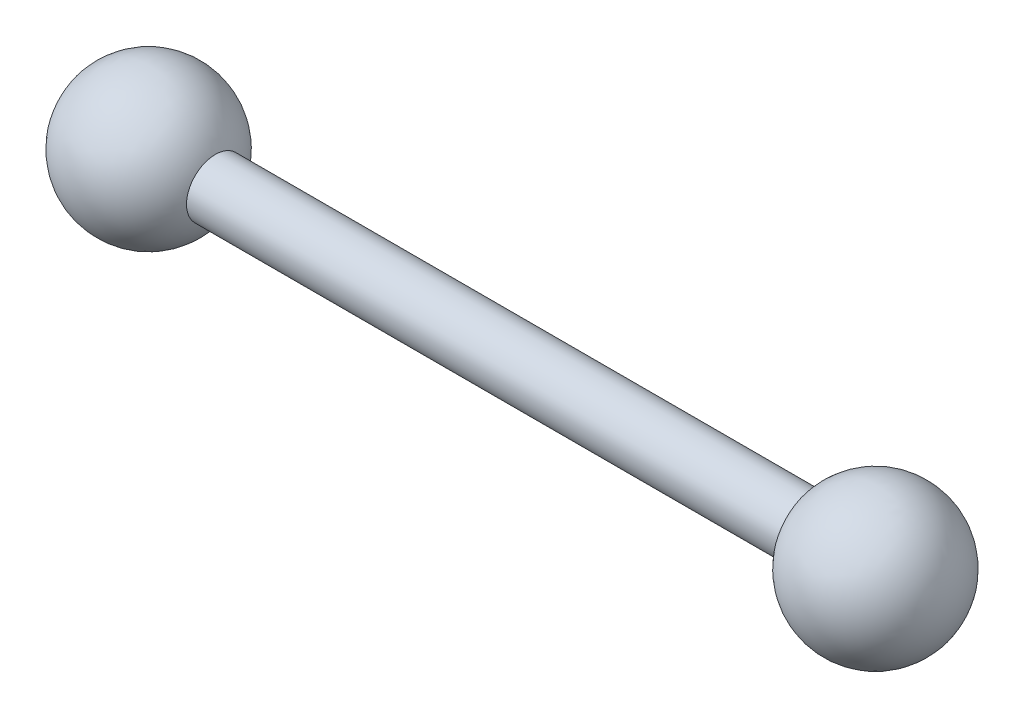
SolidWorks part; units mm, degrees
ref_plane "Plan1" through (0, 0, 0) normal (0, 0, 1) x (1, 0, 0)
ref_plane "Plan2" through (0, 0, 0) normal (0, 1, 0) x (1, 0, 0)
ref_plane "Plan3" through (0, 0, 0) normal (1, 0, 0) x (0, 0, -1)
sketch "Esquisse1" plane through (0, 0, 0) normal (0, 0, 1) x (1, 0, 0)
  line L0 (-16.7296, 0) -> (70.9688, 0) construction
  line L1 (4.5904, 1.9819) -> (45.4096, 1.9819)
  line L2 (-5, 0) -> (55, 0)
  arc A0 (4.5904, 1.9819) -> (-5, 0) centre (0, 0) ccw
  arc A1 (55, 0) -> (45.4096, 1.9819) centre (50, 0) ccw
  dimension "D1" = 10
  dimension "D2" = 10
  dimension "D3" = 50
revolve "Base-Révolution" add sketch "Esquisse1" angle 360 about L0
